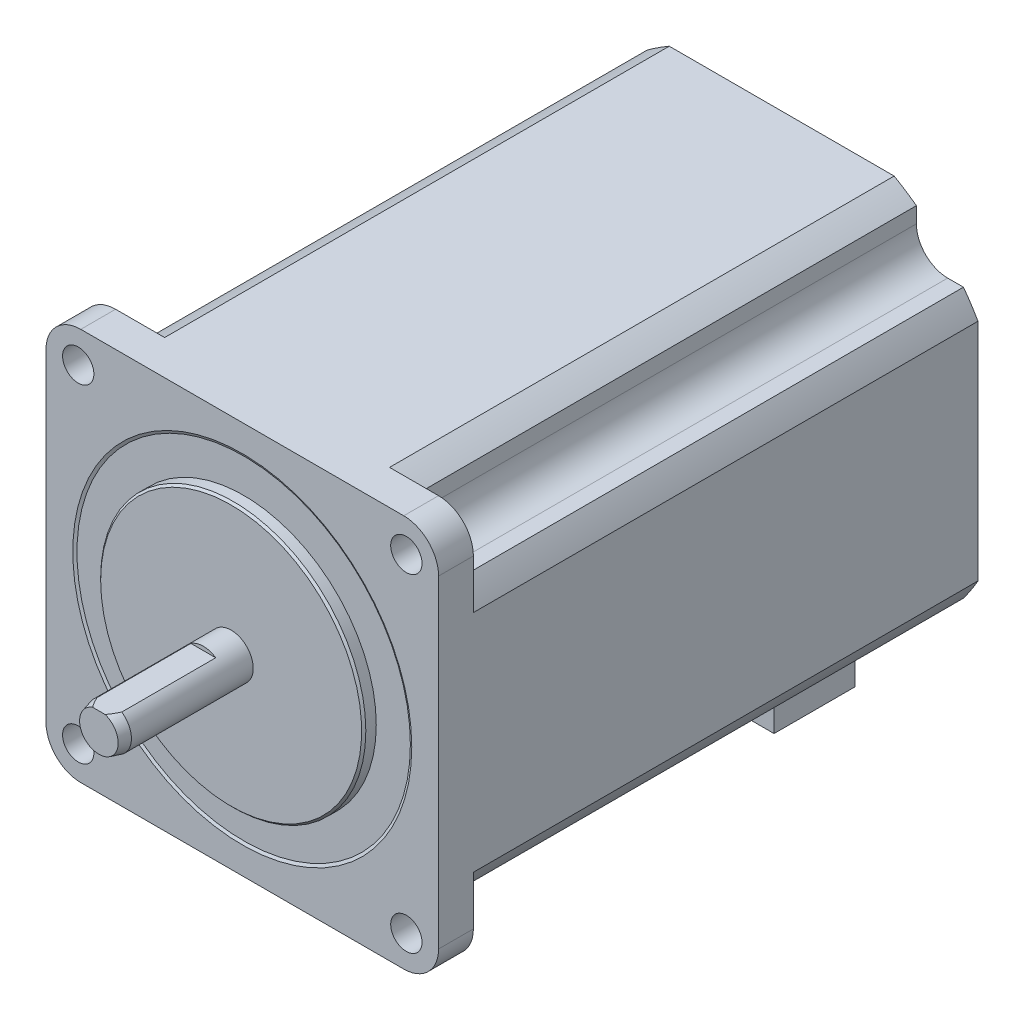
SolidWorks part; units mm, degrees
ref_plane "正面" through (0, 0, 0) normal (0, 0, 1) x (1, 0, 0)
ref_plane "平面" through (0, 0, 0) normal (0, 1, 0) x (1, 0, 0)
ref_plane "右側面" through (0, 0, 0) normal (1, 0, 0) x (0, 0, -1)
sketch "ｽｹｯﾁ1" plane through (0, 0, 0) normal (0, 0, 1) x (1, 0, 0)
  circle A0 centre (0, 0) radius 3.175
  dimension "D1" = 6.35
extrude "押し出し1" add sketch "ｽｹｯﾁ1" along normal blind 19
sketch "ｽｹｯﾁ2" plane through (0, 0, 0) normal (0, 0, -1) x (-1, 0, 0)
  circle A0 centre (0, 0) radius 19.05
  dimension "D1" = 38.1
extrude "押し出し2" add sketch "ｽｹｯﾁ2" along normal blind 1.6
sketch "ｽｹｯﾁ3" plane through (0, 0, -1.6) normal (0, 0, -1) x (-1, 0, 0)
  line L1 (-28.2, 28.2) -> (28.2, 28.2)
  line L2 (-28.2, 28.2) -> (-28.2, -28.2)
  line L3 (-28.2, -28.2) -> (28.2, -28.2)
  line L4 (28.2, 28.2) -> (28.2, -28.2)
  line L5 (-28.2, 28.2) -> (28.2, -28.2) construction
  line L6 (-28.2, -28.2) -> (28.2, 28.2) construction
  line L7 (23.57, 23.57) -> (-23.57, 23.57) construction
  line L8 (23.57, 23.57) -> (23.57, -23.57) construction
  line L9 (23.57, -23.57) -> (-23.57, -23.57) construction
  line L10 (-23.57, 23.57) -> (-23.57, -23.57) construction
  line L11 (23.57, 23.57) -> (-23.57, -23.57) construction
  line L12 (23.57, -23.57) -> (-23.57, 23.57) construction
  circle A0 centre (23.57, 23.57) radius 2.25
  circle A1 centre (-23.57, 23.57) radius 2.25
  circle A2 centre (23.57, -23.57) radius 2.25
  circle A3 centre (-23.57, -23.57) radius 2.25
  point P0 (0, 0)
  point P6 (0, 0)
  dimension "D3" = 47.14
  dimension "D4" = 47.14
  dimension "D6" = 4.5
  dimension "D1" = 56.4
  dimension "D2" = 56.4
extrude "押し出し3" add sketch "ｽｹｯﾁ3" along normal blind 5
fillet "Fillet1" radius 5 4 edges at (28.2, -28.2, -4.1) (-28.2, -28.2, -4.1) (-28.2, 28.2, -4.1) (28.2, 28.2, -4.1)
sketch "ｽｹｯﾁ4" plane through (0, 0, -6.6) normal (0, 0, -1) x (-1, 0, 0)
  line L0 (19.35, 19.35) -> (28.2, 19.35)
  line L1 (-19.35, 28.2) -> (19.35, 28.2)
  line L2 (-19.35, 28.2) -> (-19.35, 19.35)
  line L3 (-19.35, -28.2) -> (19.35, -28.2)
  line L4 (19.35, 28.2) -> (19.35, 19.35)
  line L5 (-19.35, 28.2) -> (19.35, -28.2) construction
  line L6 (-19.35, -28.2) -> (19.35, 28.2) construction
  line L7 (-28.2, 19.35) -> (-19.35, 19.35)
  line L8 (-28.2, 19.35) -> (-28.2, -19.35)
  line L9 (-28.2, -19.35) -> (-19.35, -19.35)
  line L10 (28.2, 19.35) -> (28.2, -19.35)
  line L11 (-28.2, 19.35) -> (28.2, -19.35) construction
  line L12 (-28.2, -19.35) -> (28.2, 19.35) construction
  line L13 (-19.35, -19.35) -> (-19.35, -28.2)
  line L14 (19.35, -19.35) -> (28.2, -19.35)
  line L15 (19.35, -19.35) -> (19.35, -28.2)
  circle A0 centre (0, 0) radius 32.5
  point P0 (0, 0)
  point P6 (0, 0)
  dimension "D5" = 65
  dimension "D1" = 38.7
  dimension "D2" = 56.4
  dimension "D3" = 56.4
  dimension "D4" = 38.7
extrude "押し出し4" add sketch "ｽｹｯﾁ4" along normal blind 72.5 contours L10 A0 L0 L4 L1 L2 L7 L8 L9 L13 L3 L15 L14
fillet "Fillet2" radius 4.5 4 edges at (19.35, -19.35, -42.85) (-19.35, -19.35, -42.85) (-19.35, 19.35, -42.85) (19.35, 19.35, -42.85)
sketch "Sketch1" plane through (0, -28.2, 0) normal (0, -1, 0) x (1, 0, 0)
  line L0 (16.1558, -79.1) -> (-16.1558, -79.1) construction
  line L1 (-10.5, -79.1) -> (10.5, -79.1)
  line L2 (-10.5, -79.1) -> (-10.5, -67.5)
  line L3 (-10.5, -67.5) -> (10.5, -67.5)
  line L4 (10.5, -79.1) -> (10.5, -67.5)
  dimension "D1" = 11.6
  dimension "D2" = 21
  dimension "D3" = 10.5
extrude "Extrude1" add sketch "Sketch1" along normal blind 10
chamfer "Chamfer5" distance 1.5 angle 15 1 edges at (3.175, 0, 19)
sketch "Sketch2" plane through (0, 0, 19) normal (0, 0, 1) x (1, 0, 0)
  line L1 (-4.7278, 5.1185) -> (3.4221, 5.1185)
  line L2 (-4.7278, 5.1185) -> (-4.7278, 2.625)
  line L3 (-4.7278, 2.625) -> (3.4221, 2.625)
  line L4 (3.4221, 5.1185) -> (3.4221, 2.625)
  dimension "D1" = 2.625
extrude "Extrude2" cut sketch "Sketch2" against normal blind 15
sketch "Sketch6" plane through (0, 0, -1.6) normal (0, 0, 1) x (1, 0, 0)
  circle A0 centre (0, 0) radius 19.05
  circle A1 centre (0, 0) radius 24.35
  dimension "D1" = 48.7
  dimension "D2" = 38.1
extrude "Extrude6" cut sketch "Sketch6" against normal blind 0.2
chamfer "Chamfer6" distance 0.2 distance2 0.4 1 edges at (24.35, 0, -1.8)
chamfer "Chamfer2" distance 0.3 angle 45 1 edges at (-19.05, 0, 0)
sketch "Sketch4" plane through (0, 0, -79.1) normal (0, 0, -1) x (-1, 0, 0)
  circle A0 centre (0, 0) radius 3.175
  dimension "D1" = 6.35
extrude "Extrude4" add sketch "Sketch4" along normal blind 16
sketch "Sketch5" plane through (0, 0, -95.1) normal (0, 0, -1) x (-1, 0, 0)
  line L1 (-2.9986, 5.5143) -> (3.3195, 5.5143)
  line L2 (-2.9986, 5.5143) -> (-2.9986, 2.625)
  line L3 (-2.9986, 2.625) -> (3.3195, 2.625)
  line L4 (3.3195, 5.5143) -> (3.3195, 2.625)
  dimension "D2" = 2.625
extrude "Extrude5" cut sketch "Sketch5" against normal blind 15
chamfer "Chamfer4" distance 1.5 angle 15 1 edges at (0, -3.175, -95.1)
